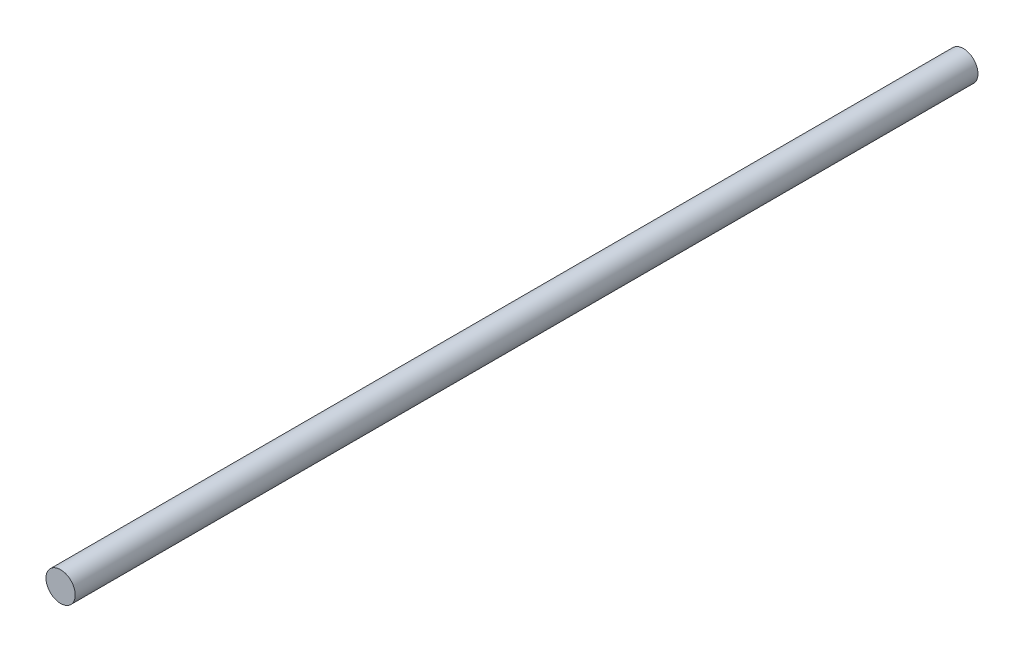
SolidWorks part; units mm, degrees
ref_plane "Front Plane" through (0, 0, 0) normal (0, 0, 1) x (1, 0, 0)
ref_plane "Top Plane" through (0, 0, 0) normal (0, 1, 0) x (1, 0, 0)
ref_plane "Right Plane" through (0, 0, 0) normal (1, 0, 0) x (0, 0, -1)
sketch "Sketch1" plane through (0, 0, 0) normal (0, 0, 1) x (1, 0, 0)
  circle A0 centre (0, 0) radius 30
  dimension "D1" = 60
extrude "Boss-Extrude1" add sketch "Sketch1" against normal blind 1850
